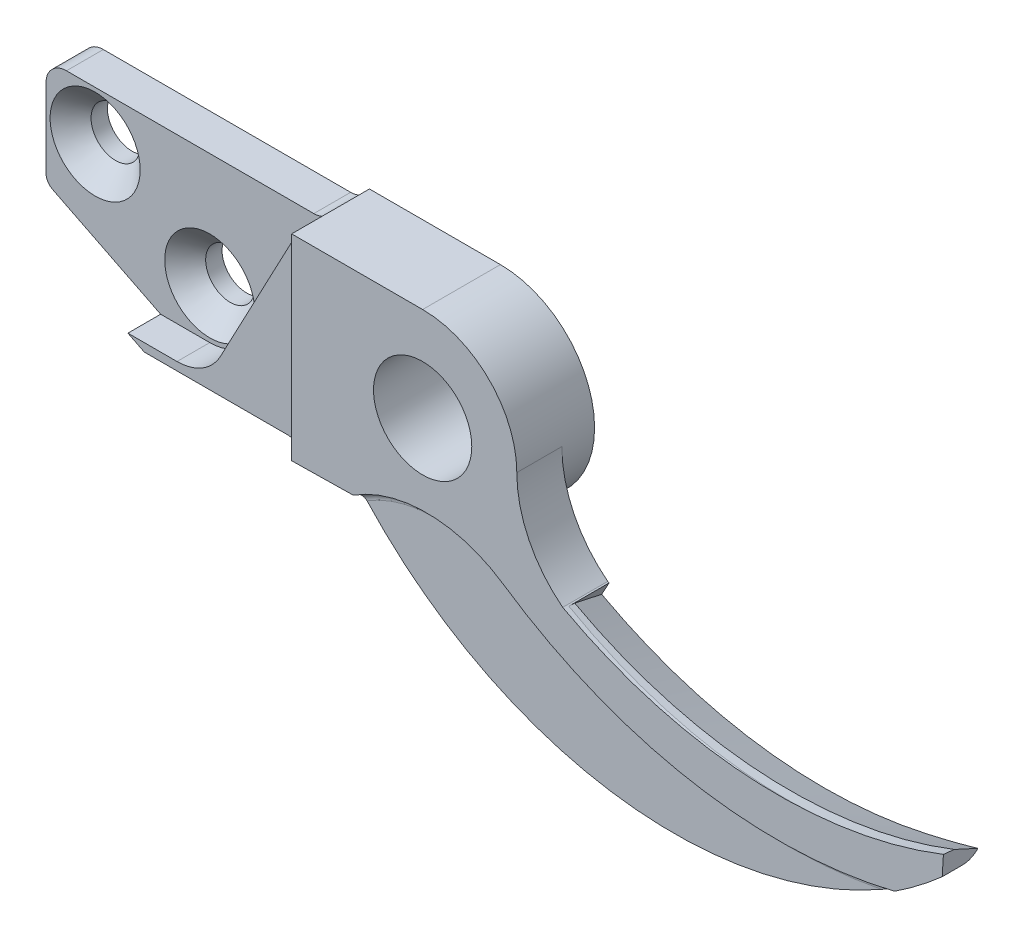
SolidWorks part; units mm, degrees
ref_plane "Plane1" through (0, 0, 0) normal (0, 0, 1) x (1, 0, 0)
ref_plane "Plane2" through (0, 0, 0) normal (0, 1, 0) x (1, 0, 0)
ref_plane "Plane3" through (0, 0, 0) normal (1, 0, 0) x (0, 0, -1)
sketch "Esquisse1" plane through (0, 0, 0) normal (0, 0, 1) x (1, 0, 0)
  line L0 (0, 0) -> (0, -13)
  line L1 (0, -13) -> (16, -21)
  line L2 (16, -21) -> (35, -21)
  line L3 (0, 0) -> (35, 0)
  line L4 (35, 0) -> (35, 1.5)
  line L5 (35, -21) -> (35, -22.5)
  line L6 (35, 1.5) -> (51, 1.5)
  line L7 (77, -10) -> (65.9042, -24.2936) construction
  line L8 (68.1086, -21.454) -> (114.6058, -24.2936) construction
  line L9 (91.3572, -22.8738) -> (95.3694, 42.8228) construction
  line L10 (114.6058, -24.2936) -> (114.4545, -26.7697)
  line L11 (35, -22.5) -> (42.5258, -22.3769)
  arc A0 (51, 1.5) -> (62.5, -10) centre (51, -10) cw
  circle A1 centre (51, -10) radius 6
  arc A2 (114.4545, -26.7697) -> (42.5258, -22.3769) centre (80.6866, 11.3911) cw
  arc A3 (62.5, -10) -> (68.1086, -21.454) centre (77, -10) ccw
  arc A4 (68.1086, -21.454) -> (114.6058, -24.2936) centre (94.3893, 26.7746) ccw
  circle A5 centre (6, -6) radius 3
  circle A6 centre (20, -14) radius 3
  point P12 (116, -5)
  point P14 (114.6058, -24.2936)
  point P19 (91.3572, -22.8738)
  dimension "D1" = 12
extrude "Base-Extrusion" add sketch "Esquisse1" along normal blind 9.5
fillet "Congé1" radius 1.5
fillet "Congé2" radius 2.5
sketch "Esquisse2" plane through (0, 0, 9.5) normal (0, 0, 1) x (1, 0, 0)
  line L0 (25.3021, -16.8085) -> (35, 1.5)
  line L1 (20, -20) -> (14, -20)
  line L2 (0.8292, -13.4146) -> (16, -21) construction
  line L3 (14, -20) -> (0, -15)
  line L4 (0, -15) -> (0, 1.5)
  line L5 (0, 1.5) -> (35, 1.5)
  arc A0 (20, -20) -> (25.3021, -16.8085) centre (20, -14) ccw
extrude "Enlèv. mat.-Extru.1" cut sketch "Esquisse2" against normal blind 5
sketch "Esquisse3" plane through (0, 0, 9.5) normal (0, 0, 1) x (1, 0, 0)
  line L0 (35, 1.5) -> (35, -22.5)
  line L1 (35, -22.5) -> (10.5, -22.5)
  line L2 (10.5, -22.5) -> (10.5, 1.5)
  line L3 (10.5, 1.5) -> (35, 1.5)
extrude "Enlèv. mat.-Extru.2" cut sketch "Esquisse3" against normal blind 1
fillet "Congé3" radius 1
chamfer "Chanfrein3" distance 2.5 angle 45
chamfer "Chanfrein4" distance 2.5 angle 45
sketch "Esquisse4" plane through (0, 0, 0) normal (0, 0, -1) x (-1, 0, 0)
  line L0 (-51, -21.5) -> (-42.5258, -22.3769)
  line L1 (-42.5258, -22.3769) -> (-44.4383, -40.8601)
  line L2 (-44.4383, -40.8601) -> (-121.9293, -40.8601)
  line L3 (-121.9293, -40.8601) -> (-121.9293, -10)
  line L4 (-121.9293, -10) -> (-62.5, -10)
  arc A0 (-62.5, -10) -> (-51, -21.5) centre (-51, -10) ccw
extrude "Enlèv. mat.-Extru.3" cut sketch "Esquisse4" against normal blind 4
sketch "Esquisse6" plane through (0, 0, 9.5) normal (0, 0, 1) x (1, 0, 0)
  line L0 (42.5258, -22.3769) -> (65.1973, -57.9226)
  line L1 (65.1973, -57.9226) -> (114.4545, -29.4688)
  arc A0 (114.4545, -29.4688) -> (60.858, -22.6377) centre (94.3893, 26.7746) cw
  arc A1 (60.858, -22.6377) -> (42.5258, -22.3769) centre (51.4937, -36.4373) ccw
extrude "Enlèv. mat.-Extru.4" cut sketch "Esquisse6" against normal blind 1
fillet "Congé10" radius 1
fillet "Congé11" radius 3
ref_plane "Plan4" through (94.5, 0, 0) normal (-1, 0, 0) x (0, 0, 1)
sketch "Esquisse7" plane through (94.5, 0, 0) normal (-1, 0, 0) x (0, 0, 1)
  line L0 (9.5, -28.1414) -> (8.16, -28.28)
  line L1 (9.5, -26.7697) -> (9.5, -31.2168) construction
  line L2 (8.16, -28.28) -> (4, -30.08)
  line L3 (4, -36.565) -> (4, -21.9908) construction
  line L4 (4, -30.08) -> (4, -27.8)
  line L5 (4, -27.8) -> (9.5, -27.8)
  line L6 (9.5, -27.8) -> (9.5, -28.1414)
  line L7 (7, 26.7746) -> (1.3017, 26.7746) construction
  line L8 (9.5, 26.7746) -> (4, 26.7746) construction
revolve "Enlever de la matière-Pivoter1" cut sketch "Esquisse7" angle 57 about L7
